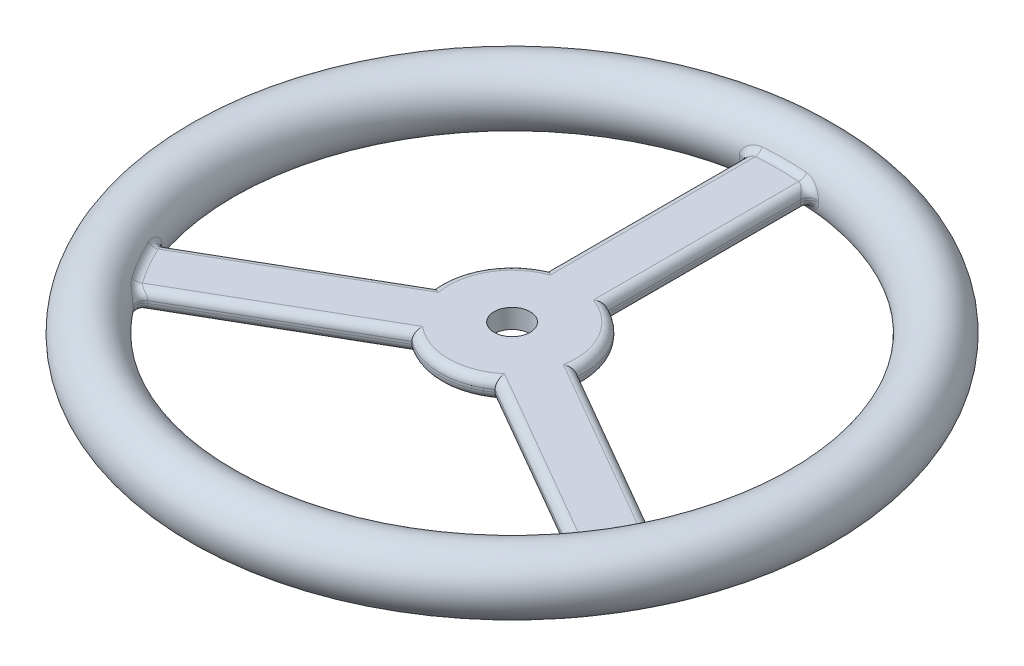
SolidWorks part; units mm, degrees
ref_plane "Face" through (0, 0, 0) normal (0, 0, 1) x (1, 0, 0)
ref_plane "Dessus" through (0, 0, 0) normal (0, 1, 0) x (1, 0, 0)
ref_plane "Droite" through (0, 0, 0) normal (1, 0, 0) x (0, 0, -1)
sketch "Esquisse1" plane through (0, 0, 0) normal (0, 0, 1) x (1, 0, 0)
  line L0 (0, 38.7633) -> (0, -48.4922) construction
  circle A0 centre (-125, 0) radius 12.5
  dimension "D1" = 25
  dimension "D2" = 125
revolve "Base-Révolution" add sketch "Esquisse1" angle 360 about L0
sketch "Esquisse2" plane through (0, 0, 0) normal (0, 1, 0) x (1, 0, 0)
  line L0 (0, 0) -> (0, 151.6727) construction
  line L1 (-12.5, 121.5533) -> (12.5, 121.5533)
  line L2 (-12.5, 121.5533) -> (-12.5, 27.2718)
  line L3 (111.5183, -49.9514) -> (99.0183, -71.602)
  line L4 (12.5, 121.5533) -> (12.5, 27.2718)
  line L5 (111.5183, -49.9514) -> (29.8681, -2.8106)
  line L6 (99.0183, -71.602) -> (17.3681, -24.4612)
  line L7 (-99.0183, -71.602) -> (-111.5183, -49.9514)
  line L8 (-99.0183, -71.602) -> (-17.3681, -24.4612)
  line L9 (-111.5183, -49.9514) -> (-29.8681, -2.8106)
  arc A0 (-12.5, 27.2718) -> (-29.8681, -2.8106) centre (0, 0) ccw
  arc A1 (29.8681, -2.8106) -> (12.5, 27.2718) centre (0, 0) ccw
  arc A2 (-17.3681, -24.4612) -> (17.3681, -24.4612) centre (0, 0) ccw
  dimension "D3" = 60
  dimension "D1" = 25
  dimension "D2" = 12.5
extrude "Boss.-Extru.1" add sketch "Esquisse2" along normal mid plane 8
fillet "Congé1" radius 3.5
sketch "Esquisse3" plane through (0, -4, 0) normal (0, -1, 0) x (1, 0, 0)
  circle A0 centre (0, 0) radius 7.5
  dimension "D1" = 15
extrude "Enlèv. mat.-Extru.1" cut sketch "Esquisse3" against normal through all
